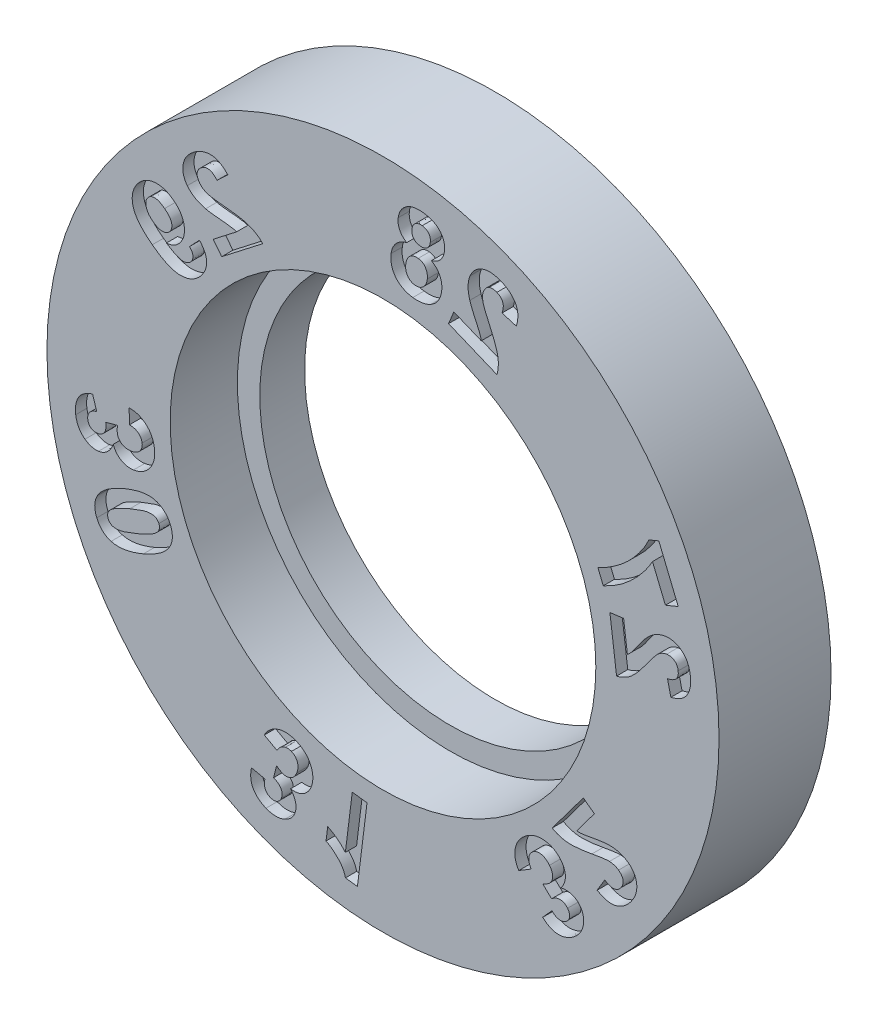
SolidWorks part; units mm, degrees
ref_plane "Front Plane" through (0, 0, 0) normal (0, 0, 1) x (1, 0, 0)
ref_plane "Top Plane" through (0, 0, 0) normal (0, 1, 0) x (1, 0, 0)
ref_plane "Right Plane" through (0, 0, 0) normal (1, 0, 0) x (0, 0, -1)
imported_body "Imported1"
other "DeleteFace3"
sketch "Sketch1" plane through (0, 0, 0) normal (0, 0, 1) x (1, 0, 0)
  line L0 (0, 0) -> (0, 16.3507) construction
  line L1 (0, 0) -> (14.1601, 8.1754) construction
  line L2 (0, 0) -> (14.1601, -8.1754) construction
  line L3 (0, 0) -> (0, -16.3507) construction
  line L4 (0, 0) -> (-14.1601, -8.1754) construction
  line L5 (0, 0) -> (-14.1601, 8.1754) construction
  circle A0 centre (0, 0) radius 10.4416 construction
  text T0 "27    28    29    30    31    32" font "Arial" height 3.5
  point P11 (0, 0)
  dimension "D1" = 6
extrude "Cut-Extrude1" cut sketch "Sketch1" against normal blind 0.5
